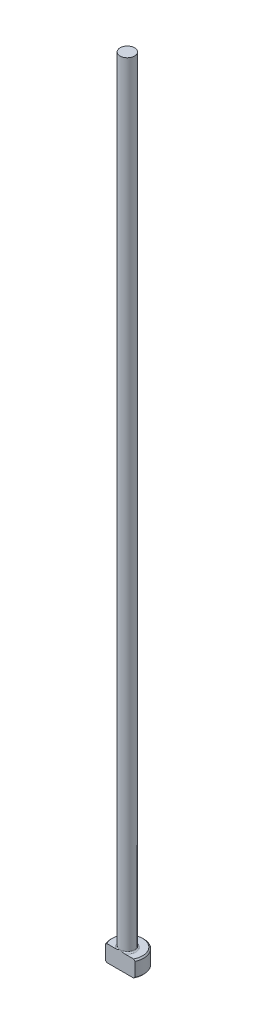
SolidWorks part; units mm, degrees
ref_plane "Front Plane" through (0, 0, 0) normal (0, 0, 1) x (1, 0, 0)
ref_plane "Top Plane" through (0, 0, 0) normal (0, 1, 0) x (1, 0, 0)
ref_plane "Right Plane" through (0, 0, 0) normal (1, 0, 0) x (0, 0, -1)
sketch "Sketch1" plane through (0, 0, 0) normal (0, 0, 1) x (1, 0, 0)
  line L0 (0, 259.9588) -> (0, -15.1925) construction
  line L1 (0, 0) -> (-3.175, 0)
  line L2 (-3.175, 0) -> (-3.175, 3.175)
  line L3 (-3.175, 3.175) -> (-1.3881, 3.175)
  line L4 (-1.3881, 3.175) -> (-1.3881, 152.4)
  line L5 (-1.3881, 152.4) -> (0, 152.4)
  line L6 (0, 152.4) -> (0, 0)
  dimension "L" = 152.4
  dimension "H" = 6.35
  dimension "T" = 3.175
  dimension "D" = 2.7762
revolve "Revolve1" add sketch "Sketch1" angle 360 about L0
chamfer "Chamfer1" distance 0.254 angle 45 2 edges at (0, 3.175, 3.175) (0, 0, 3.175)
fillet "Fillet1" radius 0.254 1 edges at (0, 3.175, 1.3881)
sketch "Sketch2" plane through (0, 0, 0) normal (0, 1, 0) x (1, 0, 0)
  line L0 (-2.8555, -1.3881) -> (2.8555, -1.3881)
  circle A0 centre (0, 0) radius 3.175 construction
  arc A1 (-2.8555, -1.3881) -> (2.8555, -1.3881) centre (0, 0) ccw
  circle A3 centre (0, 0) radius 1.3881 construction
  dimension "D1" = 0
extrude "Key" cut sketch "Sketch2" along normal through all
sketch "Pocket Sketch" plane through (0, 0, 0) normal (0, 0, 1) x (1, 0, 0)
  line L0 (-3.5719, 0) -> (-3.5719, 3.2004)
  line L1 (-3.5719, 3.2004) -> (-2.3485, 3.2004)
  line L2 (-1.5865, 3.9624) -> (-1.5865, 22.225)
  line L3 (-1.5865, 22.225) -> (0, 22.225)
  line L4 (0, 22.225) -> (0, 0)
  line L5 (0, 0) -> (-3.5719, 0)
  line L6 (0, 12.6104) -> (0, -2.4989) construction
  line L7 (-3.175, 2.921) -> (-3.175, 0.254) construction
  line L8 (2.921, 3.175) -> (-2.921, 3.175) construction
  line L9 (-1.3881, 152.4) -> (-1.3881, 3.429) construction
  line L10 (-2.3485, 3.2004) -> (-1.5865, 3.9624)
  point P3 (-1.5865, 3.2004)
  dimension "D1" = 7.1437
  dimension "D2" = 0.3969
  dimension "D3" = 0.0254
  dimension "D4" = 0.1984
  dimension "D5" = 3.1731
  dimension "D6" = 22.225
